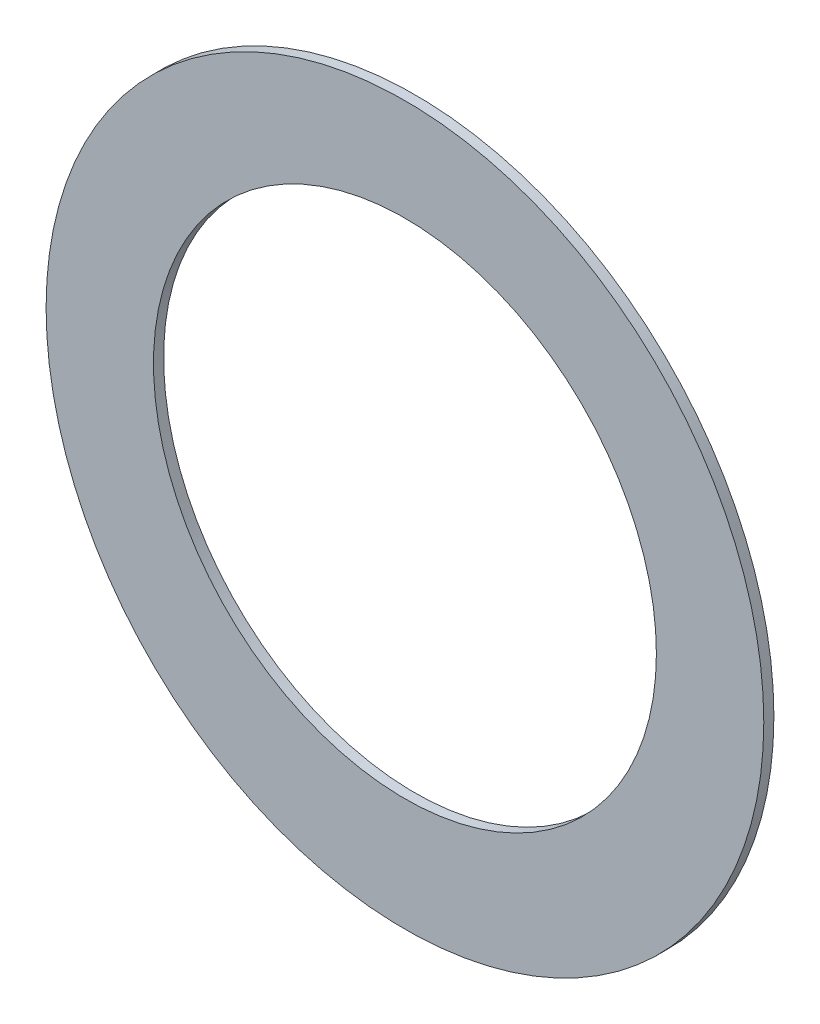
SolidWorks part; units mm, degrees
ref_plane "Front Plane" through (0, 0, 0) normal (0, 0, 1) x (1, 0, 0)
ref_plane "Top Plane" through (0, 0, 0) normal (0, 1, 0) x (1, 0, 0)
ref_plane "Right Plane" through (0, 0, 0) normal (1, 0, 0) x (0, 0, -1)
sketch "Sketch1" plane through (0, 0, 0) normal (0, 0, 1) x (1, 0, 0)
  circle A0 centre (0, 0) radius 142
  circle A1 centre (0, 2.2038) radius 99.5
  dimension "D1" = 284
  dimension "D2" = 199
extrude "Boss-Extrude1" add sketch "Sketch1" along normal blind 4
